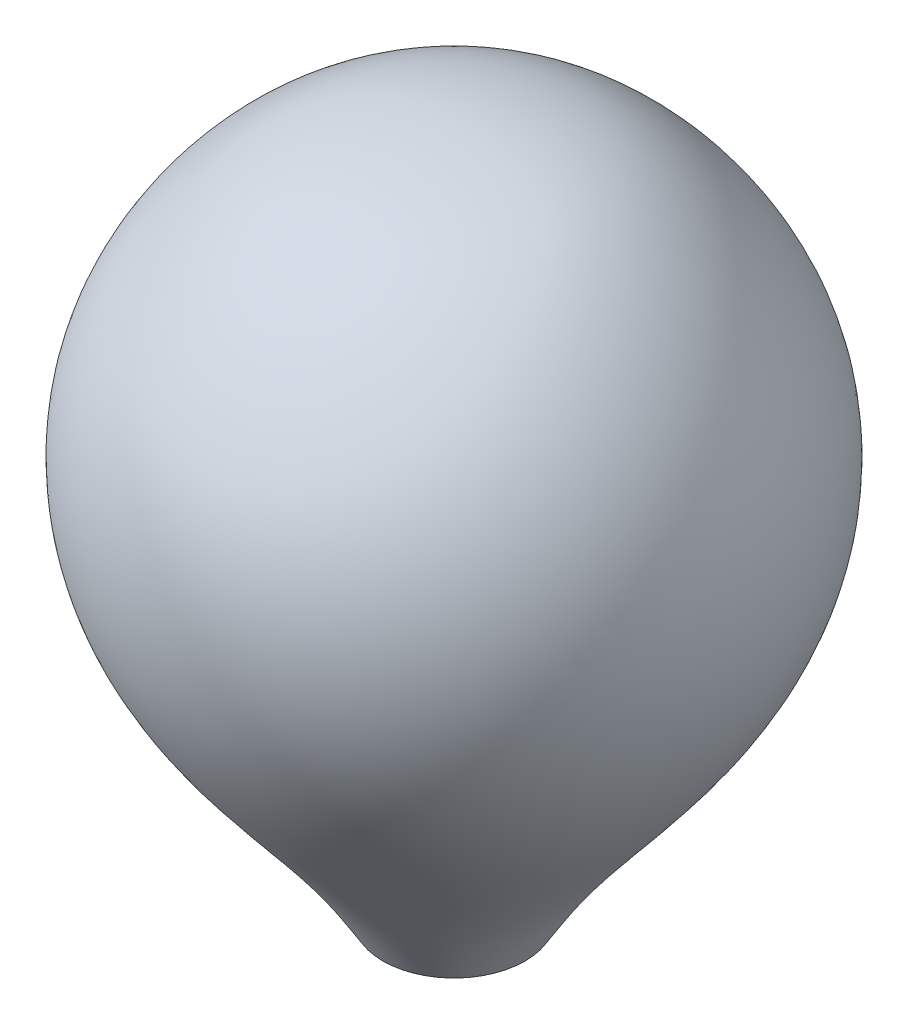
SolidWorks part; units mm, degrees
ref_plane "Plan de face" through (0, 0, 0) normal (0, 0, 1) x (1, 0, 0)
ref_plane "Plan de dessus" through (0, 0, 0) normal (0, 1, 0) x (1, 0, 0)
ref_plane "Plan de droite" through (0, 0, 0) normal (1, 0, 0) x (0, 0, -1)
sketch "Esquisse1" plane through (0, 0, 0) normal (0, 0, 1) x (1, 0, 0)
  line L0 (4.7978, -31.1722) -> (5.5361, -31.1722)
  line L5 (0, 22.5) -> (0, 22)
  spline S0 degree 3 poles (0, 22) (3.3509, 21.9687) (10.5051, 20.9639) (18.3749, 13.487) (22.5305, 3.7226) (21.8184, -6.9441) (15.7225, -17.0945) (8.9062, -24.2161) (5.5822, -29.8441) (4.7978, -31.1722) knots 0 0 0 0 0.145352 0.287547 0.441388 0.583012 0.722939 0.934621 1 1 1 1
  spline S4 degree 3 poles (0, 22.5) (3.3599, 22.485) (7.1519, 21.8445) (13.0894, 18.9756) (18.8562, 13.698) (23.0685, 3.746) (22.1345, -7.0215) (16.4074, -17.3822) (9.5894, -24.4686) (6.294, -29.9187) (5.5361, -31.1722) knots 0 0 0 0 0.144285 0.144285 0.294023 0.447847 0.588438 0.732056 0.938374 1 1 1 1
revolve "Révolution1" add sketch "Esquisse1" angle 360 about L5
sketch "Esquisse2" plane through (0, -31.1722, 0) normal (0, -1, 0) x (1, 0, 0)
  text T0 "www.a4.fr" font "Arial" height 0.01
extrude "Enlèv. mat.-Extru.1" cut sketch "Esquisse2" against normal blind 0.001
